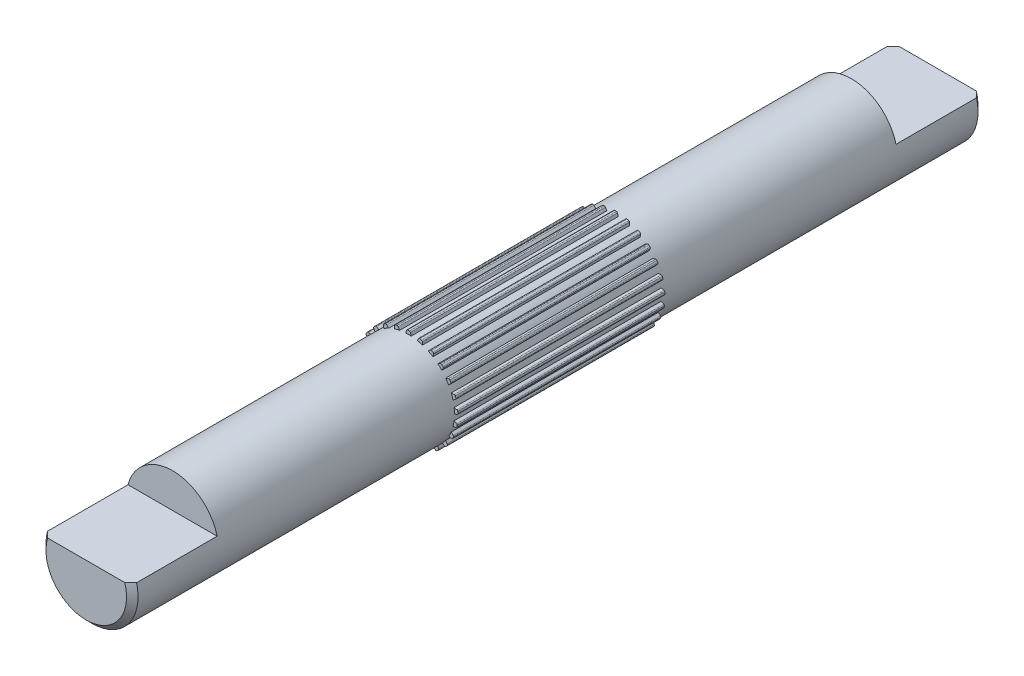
SolidWorks part; units mm, degrees
ref_plane "Face" through (0, 0, 0) normal (0, 0, 1) x (1, 0, 0)
ref_plane "Dessus" through (0, 0, 0) normal (0, 1, 0) x (1, 0, 0)
ref_plane "Droite" through (0, 0, 0) normal (1, 0, 0) x (0, 0, -1)
sketch "Esquisse1" plane through (0, 0, 0) normal (0, 0, 1) x (1, 0, 0)
  circle A0 centre (0, 0) radius 4
  dimension "D1" = 8
extrude "Extrusion1" add sketch "Esquisse1" along normal mid plane 74
sketch "Esquisse2" plane through (0, 0, 0) normal (0, 0, 1) x (1, 0, 0)
  line L0 (0, 0) -> (0, 4.9622) construction
  line L1 (-0.25, 3.948) -> (-0.1701, 4.2275)
  line L2 (-0.074, 4.3) -> (0.074, 4.3)
  line L3 (-0.25, 3.948) -> (0.25, 3.948)
  line L4 (0.25, 3.948) -> (0.1701, 4.2275)
  arc A0 (-0.1701, 4.2275) -> (-0.074, 4.3) centre (-0.074, 4.2) cw
  arc A1 (0.1701, 4.2275) -> (0.074, 4.3) centre (0.074, 4.2) ccw
  point P6 (0, 4.3)
  point P13 (0, 3.948)
  dimension "D1" = 0.1
  dimension "D2" = 4.3
  dimension "D3" = 0.5
extrude "Extrusion2" add sketch "Esquisse2" along normal mid plane 18
pattern_circular "Répétition circulaire2" count 25 over 360
sketch "Esquisse4" plane through (0, 0, 37) normal (0, 0, 1) x (1, 0, 0)
  line L1 (-4.0236, 5.2815) -> (4.351, 5.2815)
  line L2 (-4.0236, 5.2815) -> (-4.0236, 1)
  line L3 (-4.0236, 1) -> (4.351, 1)
  line L4 (4.351, 5.2815) -> (4.351, 1)
  dimension "D1" = 1
extrude "Enlèv. mat.-Extru.2" cut sketch "Esquisse4" against normal blind 7.5
mirror "Symétrie1" about plane through (0, 0, 0) normal (0, 0, 1)
chamfer "Chanfrein1" distance 0.5 angle 45
